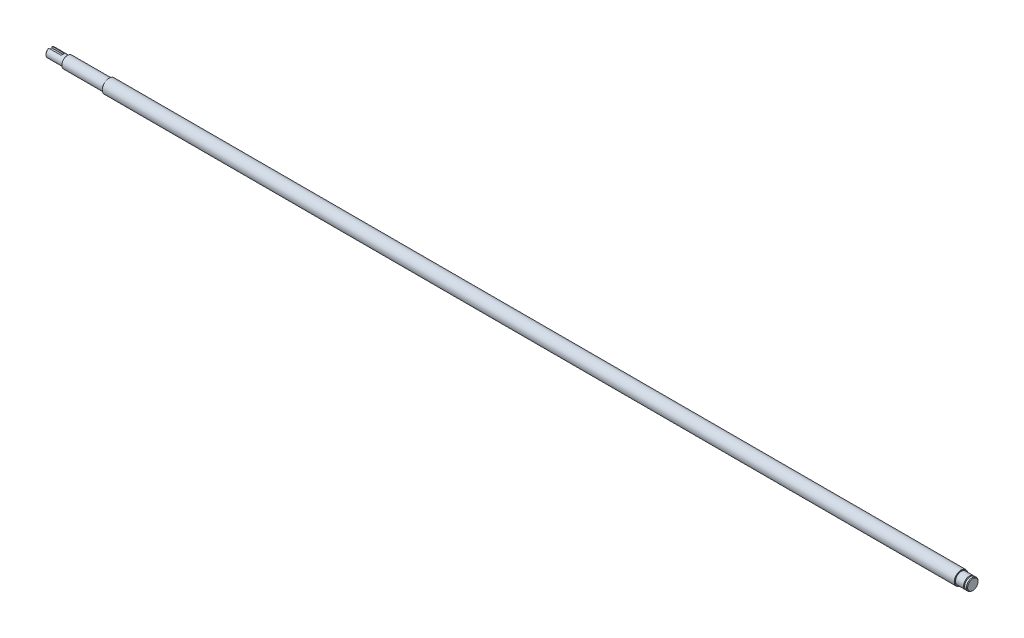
SolidWorks part; units mm, degrees
ref_plane "Front Plane" through (0, 0, 0) normal (0, 0, 1) x (1, 0, 0)
ref_plane "Top Plane" through (0, 0, 0) normal (0, 1, 0) x (1, 0, 0)
ref_plane "Right Plane" through (0, 0, 0) normal (1, 0, 0) x (0, 0, -1)
sketch "Sketch1" plane through (0, 0, 0) normal (0, 0, 1) x (1, 0, 0)
  line L0 (0, 0) -> (800, 0)
  line L1 (0, 0) -> (0, 4)
  line L2 (0, 4) -> (15, 4)
  line L3 (15, 4) -> (15, 5)
  line L4 (15, 5) -> (51, 5)
  line L5 (51, 5) -> (51, 5.9)
  line L6 (51, 5.9) -> (790, 5.9)
  line L7 (790, 5.9) -> (790, 5)
  line L9 (800, 0) -> (800, 5)
  line L10 (800, 5) -> (797.9, 5)
  line L11 (797.9, 5) -> (797.9, 3.8)
  line L12 (797.9, 3.8) -> (797, 3.8)
  line L13 (797, 3.8) -> (797, 5)
  line L14 (797, 5) -> (790, 5)
  dimension "D1" = 800
  dimension "D2" = 4
  dimension "D3" = 15
  dimension "D4" = 5
  dimension "D5" = 36
  dimension "D6" = 5.9
  dimension "D7" = 2.1
  dimension "D8" = 5
  dimension "D9" = 10
  dimension "D10" = 1.2
  dimension "D11" = 0.9
revolve "Revolve1" add sketch "Sketch1" angle 360 about L0
chamfer "Chamfer1" distance 0.5 angle 45 2 edges at (0, 0, 4) (800, 0, 5)
chamfer "Chamfer2" distance 0.2 angle 45 3 edges at (51, 0, 5.9) (790, 0, 5.9) (15, 0, 5)
ref_plane "Plane2" through (0, 2.2, 0) normal (0, 1, 0) x (1, 0, 0)
sketch "Sketch5" plane through (0, 2.2, 0) normal (0, 1, 0) x (1, 0, 0)
  line L1 (0, 1.5) -> (10, 1.5)
  line L3 (0, -1.5) -> (10, -1.5)
  line L6 (0, 1.5) -> (0, -1.5)
  arc A1 (10, -1.5) -> (10, 1.5) centre (10, 0) ccw
  point P0 (0, 0)
  dimension "D1" = 3
extrude "Cut-Extrude1" cut sketch "Sketch5" along normal blind 4 from surface at 0
